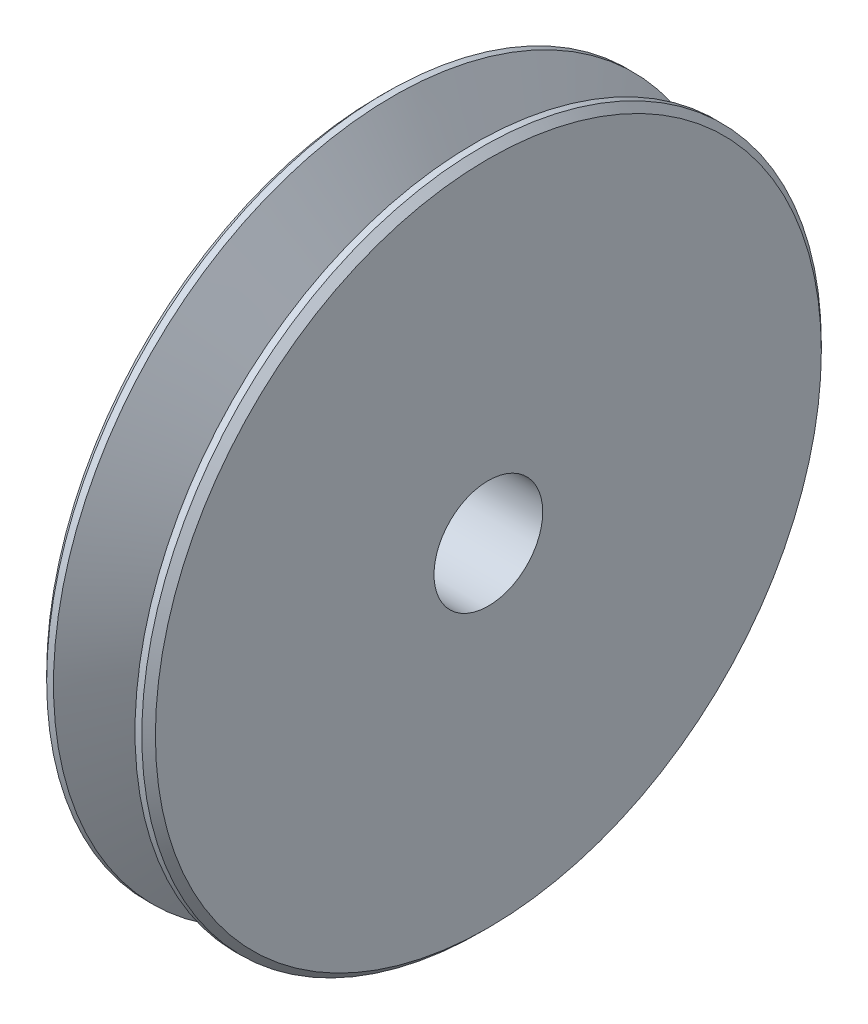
SolidWorks part; units mm, degrees
ref_plane "Plan1" through (0, 0, 0) normal (0, 0, 1) x (1, 0, 0)
ref_plane "Plan2" through (0, 0, 0) normal (0, 1, 0) x (1, 0, 0)
ref_plane "Plan3" through (0, 0, 0) normal (1, 0, 0) x (0, 0, -1)
sketch "Esquisse1" plane through (0, 0, 0) normal (0, 0, 1) x (1, 0, 0)
  line L0 (0, 5) -> (0, 25)
  line L1 (0, 0) -> (-50, 0) construction
  line L2 (0, 25) -> (1, 25)
  line L3 (1, 25) -> (4, 19.8038)
  line L4 (0, 5) -> (8, 5)
  line L5 (8, 5) -> (8, 25)
  line L6 (7, 25) -> (4, 19.8038)
  line L7 (7, 25) -> (8, 25)
  dimension "D1" = 1
  dimension "D2" = 25
revolve "Base-Révolution" add sketch "Esquisse1" angle 360 about L1
sketch "Esquisse2" plane through (0, 0, 0) normal (-1, 0, 0) x (0, 0, 1)
  circle A0 centre (0, 0) radius 6
  dimension "D1" = 12
extrude "Boss.-Extru.1" add sketch "Esquisse2" along normal blind 6
sketch "Esquisse3" plane through (-6, 0, 0) normal (-1, 0, 0) x (0, 0, 1)
  circle A0 centre (0, 0) radius 4
  dimension "D1" = 8
extrude "Enlèv. mat.-Extru.2" cut sketch "Esquisse3" against normal through all
chamfer "Chanfrein2" distance 0.5 angle 45
chamfer "Chanfrein3" distance 0.5 angle 45
chamfer "Chanfrein4" distance 0.5 angle 45
chamfer "Chanfrein5" distance 0.2 angle 45
sketch "Esquisse6" plane through (8, 0, 0) normal (1, 0, 0) x (0, 0, -1)
  circle A0 centre (0, 0) radius 4
  circle A1 centre (0, 0) radius 5.5
  dimension "D1" = 8
  dimension "D2" = 11
extrude "Boss.-Extru.6" add sketch "Esquisse6" against normal blind 14
sketch "Esquisse9" plane through (0, 0, 0) normal (-1, 0, 0) x (0, 0, 1)
  circle A0 centre (0, 13.5) radius 4.05
  circle A1 centre (0, -13.5) radius 4.05
  dimension "D1" = 13.5
  dimension "D2" = 13.5
extrude "Enlèv. mat.-Extru.9" cut sketch "Esquisse9" against normal blind 4
sketch "Esquisse10" plane through (4, 0, 0) normal (-1, 0, 0) x (0, 0, 1)
  circle A0 centre (0, -13.5) radius 4.05
  circle A1 centre (0, 13.5) radius 4.05
extrude "Enlèv. mat.-Extru.11" cut sketch "Esquisse10" against normal blind 2.34 draft 60
chamfer "Chanfrein7" distance 1 angle 45
